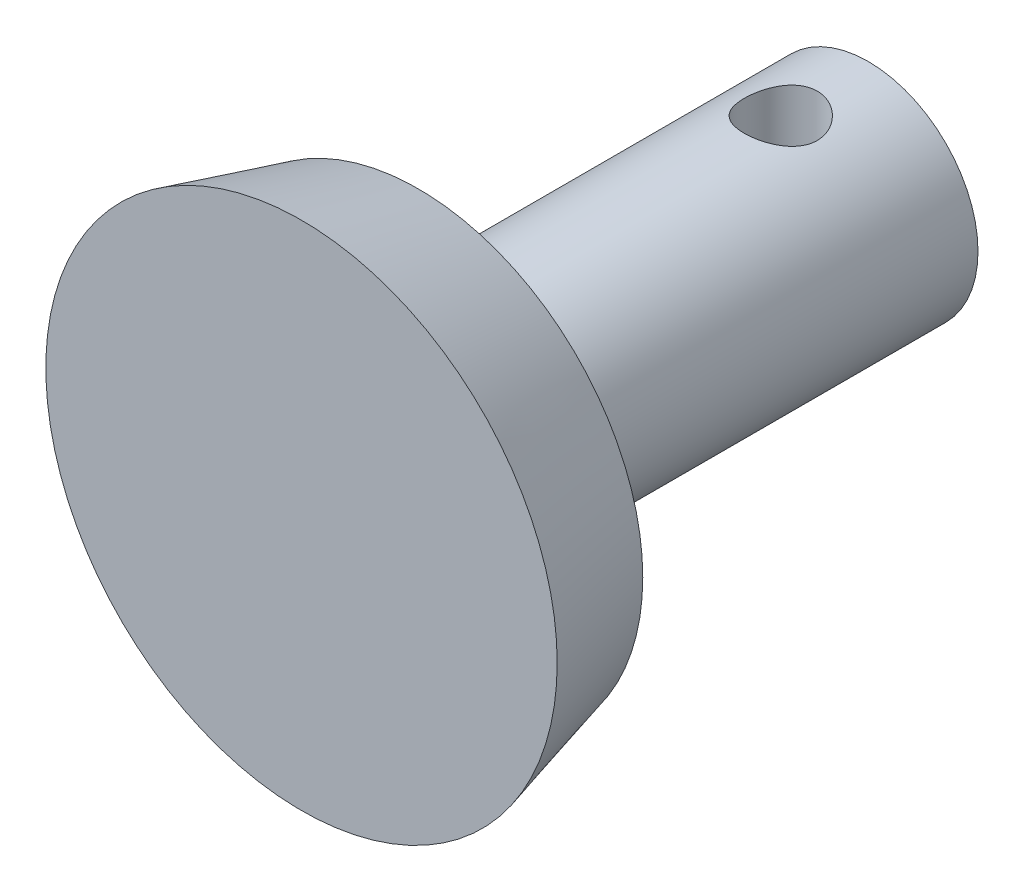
SolidWorks part; units mm, degrees
ref_plane "Front Plane" through (0, 0, 0) normal (0, 0, 1) x (1, 0, 0)
ref_plane "Top Plane" through (0, 0, 0) normal (0, 1, 0) x (1, 0, 0)
ref_plane "Right Plane" through (0, 0, 0) normal (1, 0, 0) x (0, 0, -1)
sketch "Sketch1" plane through (0, 0, 0) normal (0, 0, 1) x (1, 0, 0)
  circle A0 centre (0, 0) radius 11.1125
  dimension "D1" = 22.225
extrude "Extrude1" add sketch "Sketch1" against normal blind 5.08 draft 15
sketch "Sketch2" plane through (0, 0, -5.08) normal (0, 0, -1) x (-1, 0, 0)
  circle A0 centre (0, 0) radius 4.7625
  dimension "D1" = 9.525
extrude "Extrude2" add sketch "Sketch2" along normal blind 19.558
sketch "Sketch3" plane through (0, 0, 0) normal (0, 1, 0) x (1, 0, 0)
  line L0 (0, 24.638) -> (0, 5.08) construction
  circle A0 centre (0, 20.828) radius 1.5875
  dimension "D1" = 3.175
  dimension "D2" = 20.828
extrude "Extrude3" cut sketch "Sketch3" against normal through all and the other way through all
